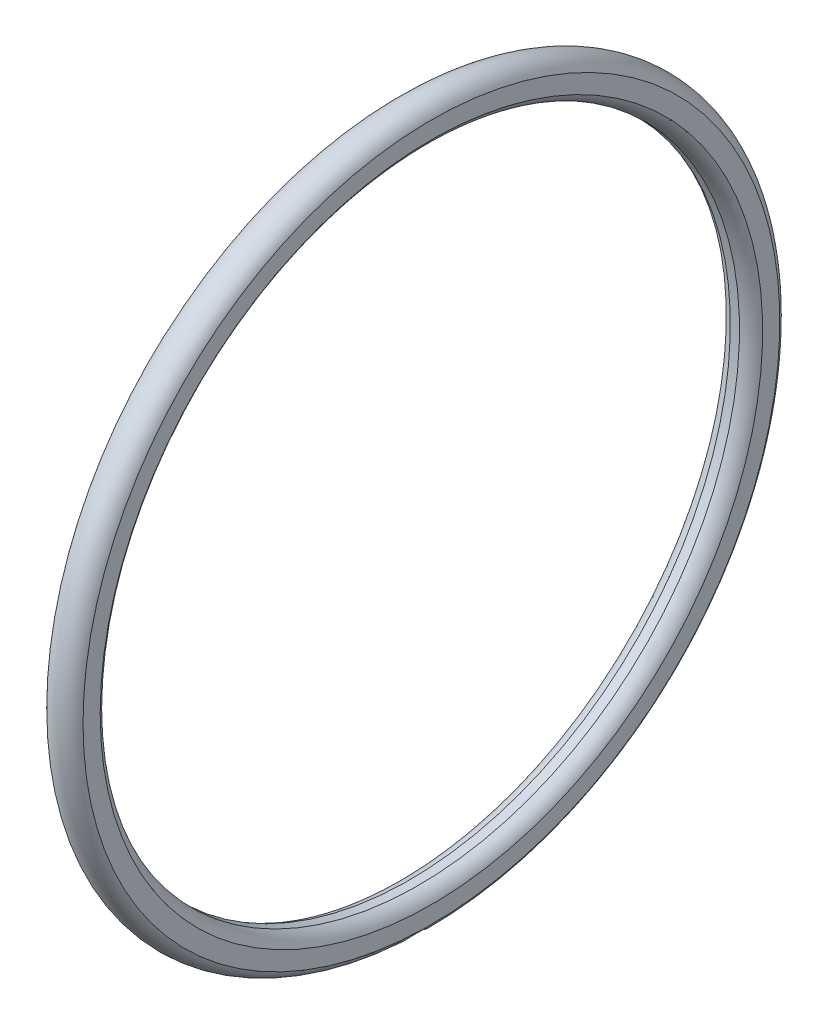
SolidWorks part; units mm, degrees
ref_plane "Face" through (0, 0, 0) normal (0, 0, 1) x (1, 0, 0)
ref_plane "Dessus" through (0, 0, 0) normal (0, 1, 0) x (1, 0, 0)
ref_plane "Droite" through (0, 0, 0) normal (1, 0, 0) x (0, 0, -1)
sketch "Esquisse1" plane through (0, 0, 0) normal (0, 0, 1) x (1, 0, 0)
  line L0 (-19.5521, 0) -> (12.4422, 0) construction
  line L1 (-2.6, 47.404) -> (-2.6, 46.146)
  line L2 (-0.629, 44.175) -> (0.629, 44.175)
  line L3 (2.4, 47.9564) -> (2.4, 45.5936)
  arc A0 (-2.6, 46.146) -> (-0.629, 44.175) centre (0, 46.775) ccw
  arc A1 (0.629, 44.175) -> (2.4, 45.5936) centre (0, 46.775) ccw
  arc A2 (2.4, 47.9564) -> (-2.6, 47.404) centre (0, 46.775) ccw
  dimension "D1" = 5.35
  dimension "D2" = 93.55
  dimension "D4" = 2.6
  dimension "D3" = 2.6
  dimension "D5" = 5
revolve "Révolution1" add sketch "Esquisse1" angle 360 about L0
